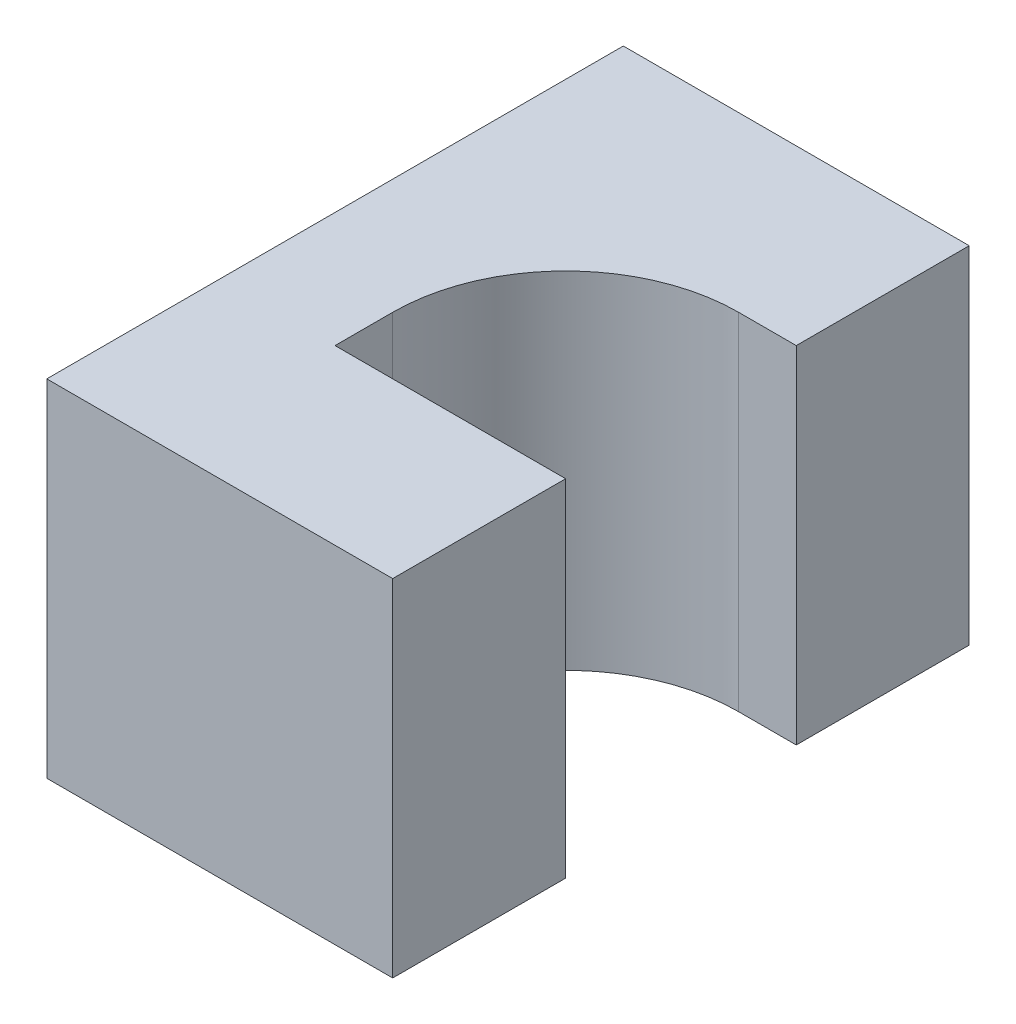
SolidWorks part; units mm, degrees
ref_plane "Front Plane" through (0, 0, 0) normal (0, 0, 1) x (1, 0, 0)
ref_plane "Top Plane" through (0, 0, 0) normal (0, 1, 0) x (1, 0, 0)
ref_plane "Right Plane" through (0, 0, 0) normal (1, 0, 0) x (0, 0, -1)
sketch "Sketch2" plane through (0, 0, 0) normal (0, 1, 0) x (0, 0, -1)
  line L0 (0, 0) -> (0, 30)
  line L1 (0, 30) -> (50, 30)
  line L2 (50, 30) -> (50, 0)
  line L3 (50, 0) -> (35, 0)
  line L4 (35, 0) -> (35, 15)
  line L5 (30, 20) -> (15, 20)
  line L6 (15, 20) -> (15, 0)
  line L7 (15, 0) -> (0, 0)
  line L8 (30, 20) -> (35, 15)
  dimension "D1" = 30
  dimension "D2" = 20
  dimension "D3" = 15
  dimension "D4" = 50
  dimension "D5" = 15
  dimension "D6" = 45
extrude "Extrude2" add sketch "Sketch2" along normal blind 30
fillet "Fillet4" radius 15 4 edges at (-17.5, 30, -32.5) (-15, 15, -35) (-20, 15, -30) (-17.5, 0, -32.5)
